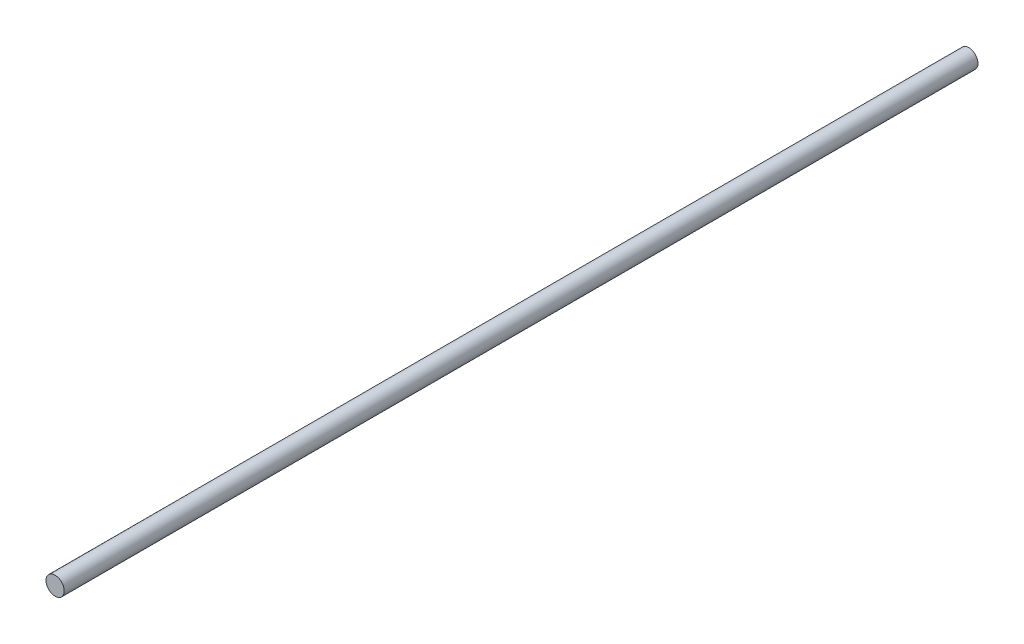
SolidWorks part; units mm, degrees
ref_plane "Plan de face" through (0, 0, 0) normal (0, 0, 1) x (1, 0, 0)
ref_plane "Plan de dessus" through (0, 0, 0) normal (0, 1, 0) x (1, 0, 0)
ref_plane "Plan de droite" through (0, 0, 0) normal (1, 0, 0) x (0, 0, -1)
sketch "Esquisse1" plane through (0, 0, 0) normal (0, 0, 1) x (1, 0, 0)
  circle A0 centre (0, 0) radius 6
  dimension "D1" = 12
extrude "Boss.-Extru.1" add sketch "Esquisse1" along normal blind 600
